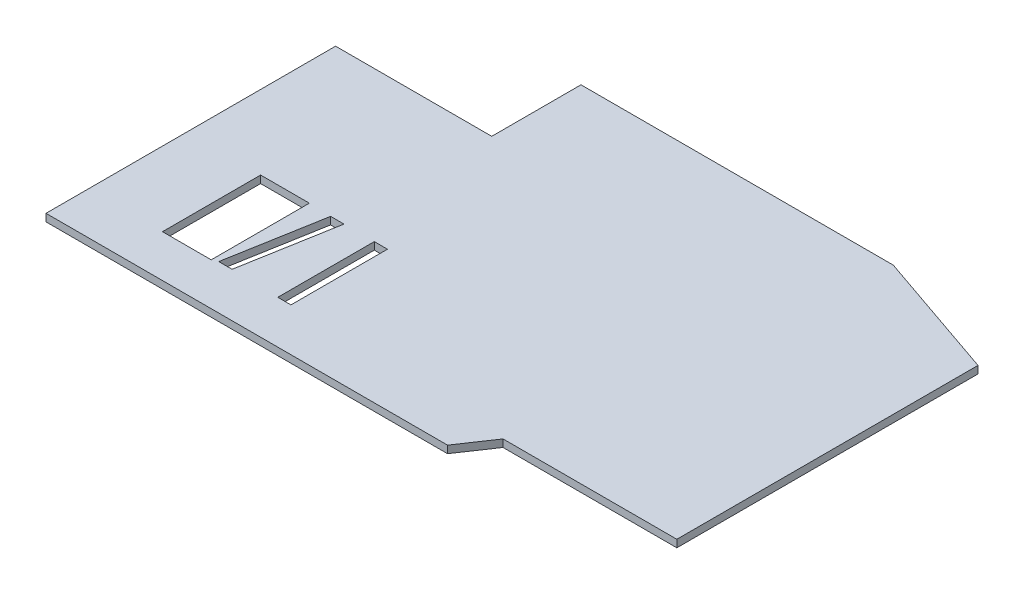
SolidWorks part; units mm, degrees
ref_plane "Front Plane" through (0, 0, 0) normal (0, 0, 1) x (1, 0, 0)
ref_plane "Top Plane" through (0, 0, 0) normal (0, 1, 0) x (1, 0, 0)
ref_plane "Right Plane" through (0, 0, 0) normal (1, 0, 0) x (0, 0, -1)
body saved out of another part "Stock-1300-C0001 AO ENCLOSURE-1"
sketch "Sketch3" plane through (0, 101.6, 0) normal (0, 1, 0) x (1, 0, 0)
  line L1 (1653.775, 1868.6625) -> (1653.775, 628.6625) construction
  line L2 (1038.775, 603.6625) -> (1038.775, 1893.6625) construction
  line L3 (1038.775, 603.6625) -> (1038.775, 1893.6625) construction
  line L4 (1653.775, 1868.6625) -> (1653.775, 628.6625) construction
  line L5 (1679.175, 1919.0625) -> (1679.175, 578.2625)
  line L6 (1038.775, 1893.6625) -> (1653.775, 1893.6625) construction
  line L7 (1038.775, 1893.6625) -> (1038.775, 603.6625) construction
  line L8 (1038.775, 603.6625) -> (1653.775, 603.6625) construction
  line L9 (1653.775, 1893.6625) -> (1653.775, 603.6625) construction
  line L10 (1013.375, 578.2625) -> (1679.175, 578.2625)
  line L11 (1013.375, 578.2625) -> (1013.375, 1919.0625)
  line L12 (1013.375, 1919.0625) -> (1679.175, 1919.0625)
  dimension "D1" = 25.4
extrude "Cut-Extrude2" cut sketch "Sketch3" against normal through all
sketch "Sketch1" plane through (0, 101.6, 0) normal (0, 1, 0) x (1, 0, 0)
  line L0 (1223.2905, 608.9849) -> (1448.1268, 1882.867) construction
  line L1 (1223.2905, 608.9849) -> (1448.1268, 1882.867) construction
  line L2 (1066.4764, 609.0127) -> (1291.3127, 1882.8948) construction
  line L3 (1066.4764, 609.0127) -> (1291.3127, 1882.8948) construction
  line L4 (1766.3818, 621.5888) -> (1991.2181, 1895.4709) construction
  line L5 (1766.3818, 621.5888) -> (1991.2181, 1895.4709) construction
  line L6 (1923.1958, 621.561) -> (2148.0321, 1895.4431) construction
  line L7 (1923.1958, 621.561) -> (2148.0321, 1895.4431) construction
  line L8 (2590.0441, 602.3423) -> (2590.273, 1895.3648) construction
  line L9 (2744.4761, 602.3149) -> (2744.705, 1895.3375) construction
  line L10 (2590.0441, 602.3423) -> (2590.273, 1895.3648) construction
  line L11 (2744.4761, 602.3149) -> (2744.705, 1895.3375) construction
  line L12 (2744.705, 1895.3375) -> (2590.273, 1895.3648) construction
  line L13 (2744.4761, 602.3149) -> (2590.0441, 602.3423) construction
  line L14 (2148.0321, 1895.4431) -> (1991.2181, 1895.4709) construction
  line L15 (1923.1958, 621.561) -> (1766.3818, 621.5888) construction
  line L16 (1448.1268, 1882.867) -> (1291.3127, 1882.8948) construction
  line L17 (1223.2905, 608.9849) -> (1066.4764, 609.0127) construction
  line L18 (2577.3418, 589.6445) -> (2577.5752, 1908.0671)
  line L19 (2757.4072, 1908.0352) -> (2577.5752, 1908.0671)
  line L20 (2757.1738, 589.6127) -> (2757.4072, 1908.0352)
  line L21 (2757.1738, 589.6127) -> (2577.3418, 589.6445)
  line L22 (1751.2445, 608.8914) -> (1980.5636, 1908.1728)
  line L23 (2163.1694, 1908.1404) -> (1980.5636, 1908.1728)
  line L24 (1933.8503, 608.8591) -> (2163.1694, 1908.1404)
  line L25 (1933.8503, 608.8591) -> (1751.2445, 608.8914)
  line L26 (1051.3391, 596.3154) -> (1280.6583, 1895.5967)
  line L27 (1463.2641, 1895.5644) -> (1280.6583, 1895.5967)
  line L28 (1233.9449, 596.283) -> (1463.2641, 1895.5644)
  line L29 (1233.9449, 596.283) -> (1051.3391, 596.3154)
  dimension "D1" = 12.7
  dimension "D2" = 12.7
  dimension "D3" = 12.7
extrude "Cut-Extrude1" cut sketch "Sketch1" against normal through all
